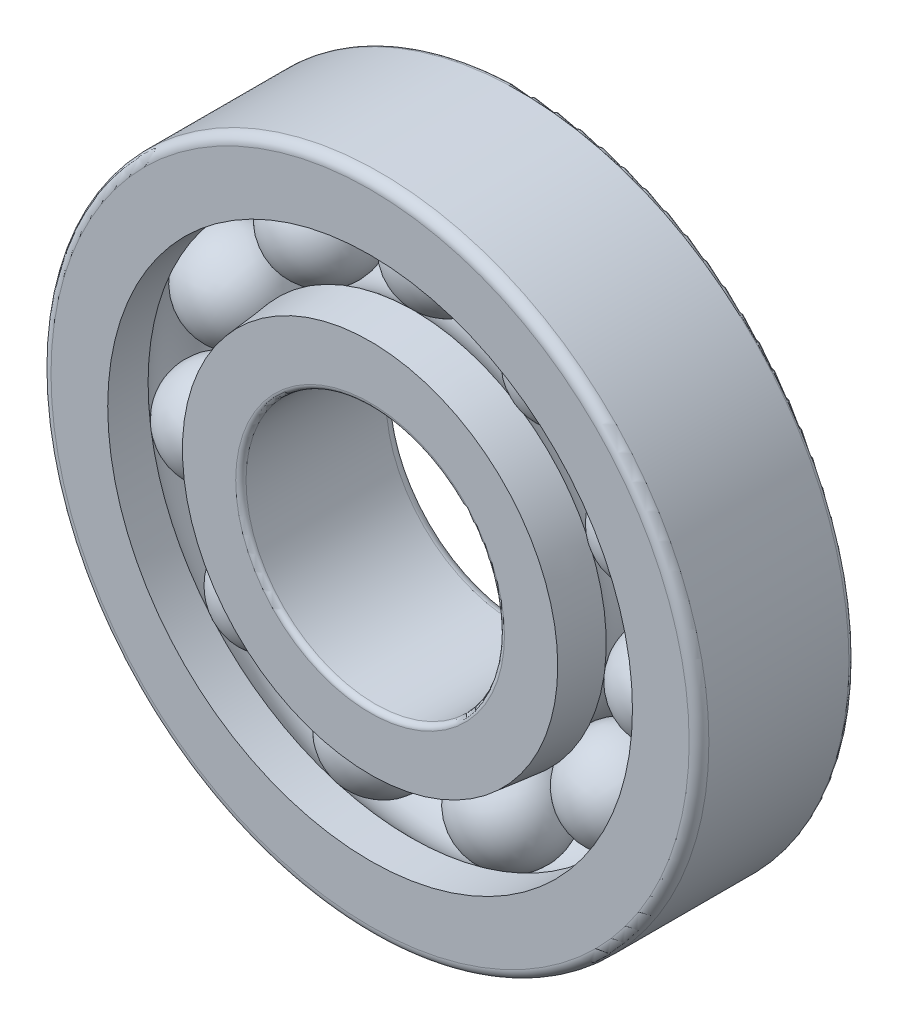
SolidWorks part; units mm, degrees
ref_plane "Front Plane" through (0, 0, 0) normal (0, 0, 1) x (1, 0, 0)
ref_plane "Top Plane" through (0, 0, 0) normal (0, 1, 0) x (1, 0, 0)
ref_plane "Right Plane" through (0, 0, 0) normal (1, 0, 0) x (0, 0, -1)
sketch "BaseSke" plane through (0, 0, 0) normal (1, 0, 0) x (0, 0, -1)
  line L0 (-47.2296, 0) -> (24.6132, 0) construction
  line L1 (-47.2296, 48.75) -> (24.6132, 48.75) construction
  line L2 (0, 129.5214) -> (0, -86.3012) construction
  line L3 (0, 59.375) -> (0, 38.125)
  line L4 (-16.5, 70) -> (16.5, 70) construction
  line L5 (-16.5, 27.5) -> (16.5, 27.5) construction
  arc A0 (0, 59.375) -> (0, 38.125) centre (0, 48.75) ccw
  dimension "Ball_diameter" = 21.25
  dimension "D1" = 48.75
  dimension "Bearing_Thickness" = 33
  dimension "Bearing_Outside_Diameter" = 140
  dimension "Bearing_Inside_Diameter" = 55
revolve "Ball" add sketch "BaseSke" angle 360 about L3
sketch "OuterRaceSke" plane through (0, 0, 0) normal (1, 0, 0) x (0, 0, -1)
  line L0 (0, 0) -> (0, 87.5396) construction
  line L1 (-16.5, 70) -> (16.5, 70)
  line L2 (-16.5, 70) -> (-16.5, 55.8333)
  line L3 (-16.5, 55.8333) -> (-7.906, 55.8333)
  line L4 (16.5, 70) -> (16.5, 57.5676)
  line L5 (-50.3916, 0) -> (55.2197, 0) construction
  line L6 (-47.2296, 48.75) -> (24.6132, 48.75) construction
  line L8 (16.5, 57.5676) -> (7.1607, 56.586)
  line L9 (0, 55.8333) -> (-0.8658, 59.0647) construction
  line L10 (0, 55.8333) -> (7.1607, 56.586) construction
  arc A0 (7.1607, 56.586) -> (-7.906, 55.8333) centre (0, 48.75) ccw
  dimension "D4" = 21.23
  dimension "D2" = 111.6667
  dimension "D3" = 6
  dimension "Angle" = 15
revolve "OuterRace" add sketch "OuterRaceSke" angle 360 about L5
sketch "InnerRaceSke" plane through (0, 0, 0) normal (1, 0, 0) x (0, 0, -1)
  line L0 (-70.8626, 0) -> (113.5527, 0) construction
  line L1 (0, 58.441) -> (0, -70.8113) construction
  line L2 (-16.5, 27.5) -> (16.5, 27.5)
  line L3 (-16.5, 27.5) -> (-16.5, 41.6667)
  line L4 (-16.5, 41.6667) -> (-7.906, 41.6667)
  line L5 (16.5, 27.5) -> (16.5, 41.6667)
  line L6 (0, 129.5214) -> (0, -86.3012) construction
  line L7 (7.906, 41.6667) -> (16.5, 41.6667)
  arc A0 (-7.906, 41.6667) -> (7.906, 41.6667) centre (0, 48.75) ccw
  arc A1 (0, 59.375) -> (0, 38.125) centre (0, 48.75) ccw construction
  dimension "D2" = 21.23
  dimension "D1" = 83.3333
revolve "InnerRace" add sketch "InnerRaceSke" angle 360 about L0
fillet "Fillet1" radius 2.1 2 edges at (27.5, 0, -16.5) (70, 0, 16.5)
fillet "Fillet2" radius 1.1 2 edges at (70, 0, -16.5) (27.5, 0, 16.5)
sketch "CutInnerRaceSke" plane through (0, 0, 0) normal (1, 0, 0) x (0, 0, -1)
  line L0 (-7.906, 41.6667) -> (-16.5, 41.6667)
  line L1 (-16.5, 41.6667) -> (-16.5, 39.9324)
  line L2 (-16.5, 39.9324) -> (-7.1607, 40.914)
  line L3 (-7.1607, 40.914) -> (0, 41.6667) construction
  line L4 (0, 58.441) -> (0, -70.8113) construction
  line L5 (-28.3066, 0) -> (35.2466, 0) construction
  arc A0 (-7.906, 41.6667) -> (-7.1607, 40.914) centre (0, 48.75) ccw
  arc A1 (-7.906, 41.6667) -> (7.906, 41.6667) centre (0, 48.75) ccw construction
  dimension "D1" = 6
revolve "CutInnerRace" cut sketch "CutInnerRaceSke" angle 360 about L5
pattern_circular "CirPatternBall" count 11 over 360 about axis through (0, 0, 0) along (0, 0, 1) of "Ball"
sketch "SimplifiedSke" plane through (0, 0, 0) normal (1, 0, 0) x (0, 0, -1)
  line L0 (37.5911, 0) -> (-37.5911, 0) construction
  circle A0 centre (0, 48.75) radius 10.625
  arc A1 (0, 59.375) -> (0, 38.125) centre (0, 48.75) ccw construction
revolve "Simplified" [suppressed] add sketch "SimplifiedSke" angle 360 about L0
equation "\"D1@BaseSke\" =  (\"Bearing_Outside_Diameter@BaseSke\"  +  \"Bearing_Inside_Diameter@BaseSke\"  )  / 4"
equation "\"Ball_diameter@BaseSke\" =  ( \"Bearing_Outside_Diameter@BaseSke\" - \"Bearing_Inside_Diameter@BaseSke\" ) / 4 "
equation "\"D2@OuterRaceSke\" = \"Bearing_Outside_Diameter@BaseSke\" -  ( \"Bearing_Outside_Diameter@BaseSke\" - \"Bearing_Inside_Diameter@BaseSke\" )  / 3"
equation "\"D4@OuterRaceSke\" = (  \"Bearing_Outside_Diameter@BaseSke\" - \"Bearing_Inside_Diameter@BaseSke\" ) / 4 -0.02"
equation "\"D3@OuterRaceSke\" = \"Angle@OuterRaceSke\"/2.5"
equation "\"D1@InnerRaceSke\" = \"Bearing_Inside_Diameter@BaseSke\" +  ( \"Bearing_Outside_Diameter@BaseSke\" - \"Bearing_Inside_Diameter@BaseSke\" )  / 3"
equation "\"D2@InnerRaceSke\" = \"D4@OuterRaceSke\""
equation "\"D1@CirPatternBall\" = int( \"D1@BaseSke\"* pi  * 2 / \"Ball_diameter@BaseSke\"/1.2 ) -1"
equation "\"D1@CutInnerRaceSke\" = \"D3@OuterRaceSke\""
